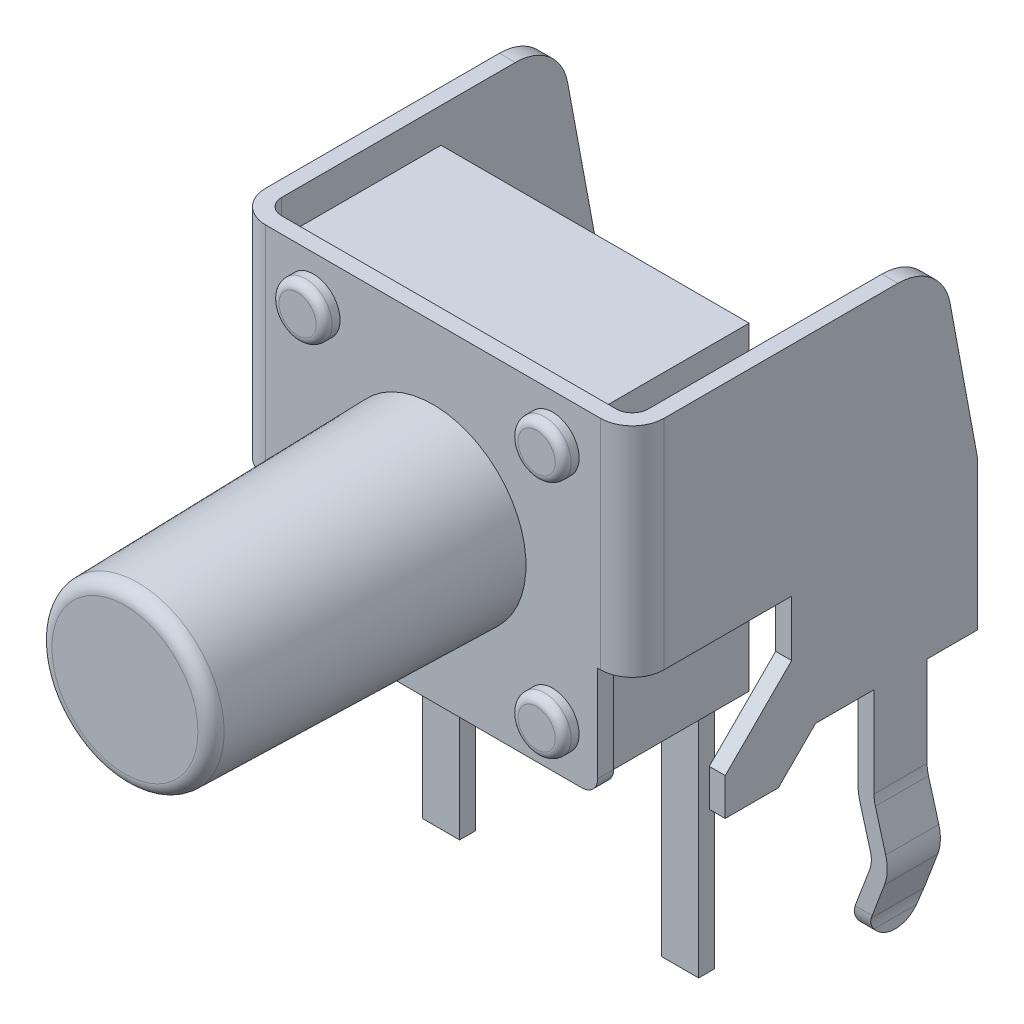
SolidWorks part; units mm, degrees
ref_plane "Front" through (0, 0, 0) normal (0, 0, 1) x (1, 0, 0)
ref_plane "Top" through (0, 0, 0) normal (0, 1, 0) x (1, 0, 0)
ref_plane "Right" through (0, 0, 0) normal (1, 0, 0) x (0, 0, -1)
sketch "Эскиз1" plane through (0, 0, 0) normal (0, 0, 1) x (1, 0, 0)
  line L0 (0, 0) -> (0, 7) construction
  line L1 (-2.9, 1) -> (2.9, 1)
  line L2 (-2.9, 1) -> (-2.9, 7)
  line L3 (-2.9, 7) -> (2.9, 7)
  line L4 (2.9, 1) -> (2.9, 7)
  dimension "D1" = 5.8
  dimension "D2" = 1
  dimension "D3" = 7
extrude "Вытянуть1" add sketch "Эскиз1" along normal blind 2.25 and the other way blind 0.5
sketch "Эскиз2" plane through (0, 0, 0) normal (0, 1, 0) x (1, 0, 0)
  line L0 (-3.15, -2.25) -> (3.15, -2.25)
  line L1 (2.9, -2.25) -> (-2.9, -2.25) construction
  line L2 (3.45, -1.95) -> (3.45, 3.95)
  line L3 (0, -2.25) -> (0, 0) construction
  line L4 (-3.15, -2.55) -> (3.15, -2.55)
  line L5 (3.75, -1.95) -> (3.75, 3.95)
  line L6 (3.45, 3.95) -> (3.75, 3.95)
  line L7 (-3.45, 3.95) -> (-3.75, 3.95)
  line L8 (-3.75, -1.95) -> (-3.75, 3.95)
  line L9 (-3.45, -1.95) -> (-3.45, 3.95)
  arc A0 (3.15, -2.25) -> (3.45, -1.95) centre (3.15, -1.95) ccw
  arc A1 (3.15, -2.55) -> (3.75, -1.95) centre (3.15, -1.95) ccw
  arc A2 (-3.15, -2.55) -> (-3.75, -1.95) centre (-3.15, -1.95) cw
  arc A3 (-3.15, -2.25) -> (-3.45, -1.95) centre (-3.15, -1.95) cw
  dimension "D1" = 0.3
  dimension "D3" = 7.5
  dimension "D4" = 6.5
  dimension "D2" = 0.3
extrude "Вытянуть2" add sketch "Эскиз2" along normal blind 7.1
sketch "Эскиз3" plane through (0, 0, 0) normal (0, 0, 1) x (1, 0, 0)
  line L0 (3.45, 0) -> (3.45, -1)
  line L1 (3.15, 0) -> (3.75, 0) construction
  line L2 (3.4869, -1.2692) -> (3.6815, -1.9654)
  line L3 (3.6677, -2.2768) -> (3.4146, -2.9464)
  line L4 (3.35, -3.3) -> (3.35, -3.5)
  line L5 (3.75, 0) -> (3.75, -1)
  line L6 (3.7758, -1.1885) -> (3.9705, -1.8846)
  line L7 (3.9483, -2.3829) -> (3.6952, -3.0525)
  line L8 (3.65, -3.3) -> (3.65, -3.5)
  line L9 (3.45, 0) -> (3.75, 0)
  line L10 (3.65, -3.5) -> (3.35, -3.5)
  line L11 (-3.5, -3.5) -> (-3.5, -3.6731) construction
  line L12 (3.5, -3.5) -> (3.5, -3.6731) construction
  line L13 (0, 0) -> (0, 2.0912) construction
  line L14 (-3.65, -3.5) -> (-3.35, -3.5)
  line L15 (-3.45, 0) -> (-3.75, 0)
  line L16 (-3.65, -3.3) -> (-3.65, -3.5)
  line L17 (-3.9483, -2.3829) -> (-3.6952, -3.0525)
  line L18 (-3.7758, -1.1885) -> (-3.9705, -1.8846)
  line L19 (-3.75, 0) -> (-3.75, -1)
  line L20 (-3.35, -3.3) -> (-3.35, -3.5)
  line L21 (-3.6677, -2.2768) -> (-3.4146, -2.9464)
  line L22 (-3.4869, -1.2692) -> (-3.6815, -1.9654)
  line L23 (-3.45, 0) -> (-3.45, -1)
  line L24 (-3.15, 0) -> (3.15, 0) construction
  arc A0 (3.6815, -1.9654) -> (3.6677, -2.2768) centre (3.2, -2.1) cw
  arc A1 (3.45, -1) -> (3.4869, -1.2692) centre (4.45, -1) ccw
  arc A2 (3.4146, -2.9464) -> (3.35, -3.3) centre (4.35, -3.3) ccw
  arc A3 (3.75, -1) -> (3.7758, -1.1885) centre (4.45, -1) ccw
  arc A4 (3.9705, -1.8846) -> (3.9483, -2.3829) centre (3.2, -2.1) cw
  arc A5 (3.6952, -3.0525) -> (3.65, -3.3) centre (4.35, -3.3) ccw
  arc A6 (-3.6952, -3.0525) -> (-3.65, -3.3) centre (-4.35, -3.3) cw
  arc A7 (-3.9705, -1.8846) -> (-3.9483, -2.3829) centre (-3.2, -2.1) ccw
  arc A8 (-3.75, -1) -> (-3.7758, -1.1885) centre (-4.45, -1) cw
  arc A9 (-3.4146, -2.9464) -> (-3.35, -3.3) centre (-4.35, -3.3) cw
  arc A10 (-3.45, -1) -> (-3.4869, -1.2692) centre (-4.45, -1) cw
  arc A11 (-3.6815, -1.9654) -> (-3.6677, -2.2768) centre (-3.2, -2.1) ccw
  dimension "D1" = 0.5
  dimension "D2" = 1
  dimension "D4" = 8
  dimension "D3" = 7
  dimension "D5" = 3.5
  dimension "D6" = 0.2
  dimension "D7" = 1.4
  dimension "D8" = 2.5
extrude "Вытянуть3" add sketch "Эскиз3" against normal up to surface (3.95 mm away)
sketch "Эскиз4" plane through (0, 0, 0) normal (1, 0, 0) x (0, 0, -1)
  line L0 (-2.55, 7.1) -> (-2.55, 0) construction
  line L2 (-2.55, -4.5) -> (-2.55, 3)
  line L3 (-2.55, 3) -> (0.45, 3)
  line L4 (0.45, 1.95) -> (-0.8, 0.7)
  line L5 (-0.8, 0.7) -> (-0.8, 0)
  line L6 (-1.95, 0) -> (0, 0) construction
  line L7 (-0.8, 0) -> (0.2, 0)
  line L8 (0.2, 0) -> (0.9, 0.7)
  line L9 (0.9, 0.7) -> (2, 0.7)
  line L10 (2, 0.7) -> (2, -3)
  line L11 (3, -3) -> (3, 0.7)
  line L12 (3, 0.7) -> (3.95, 0.7)
  line L13 (3.95, 7.1) -> (3.95, -1) construction
  line L14 (3.95, -3.5) -> (0, -3.5) construction
  line L15 (-2.55, -4.5) -> (3.95, -4.5)
  line L16 (3.95, -4.5) -> (3.95, 0.7)
  line L17 (0, -1) -> (0, 0) construction
  line L18 (0.45, 3) -> (0.45, 1.95)
  line L19 (3.95, 3.5) -> (3.4332, 6.2826)
  line L20 (-1.95, 7.1) -> (3.95, 7.1) construction
  line L21 (2.45, 7.1) -> (3.95, 7.1)
  line L22 (3.95, 7.1) -> (3.95, 3.5)
  arc A0 (2, -3) -> (3, -3) centre (2.5, -3) ccw
  arc A1 (3.4332, 6.2826) -> (2.45, 7.1) centre (2.45, 6.1) ccw
  dimension "D11" = 1
  dimension "D1" = 1
  dimension "D2" = 2.5
  dimension "D3" = 1
  dimension "D4" = 0.7
  dimension "D5" = 0.2
  dimension "D6" = 0.8
  dimension "D7" = 45
  dimension "D8" = 3
  dimension "D9" = 3
  dimension "D10" = 2.8
  dimension "D12" = 1.5
extrude "Вырез-Вытянуть1" cut sketch "Эскиз4" along normal through all from offset 3.2
mirror "Зеркальное отражение1" about plane through (0, 0, 0) normal (1, 0, 0) of "Вырез-Вытянуть1"
sketch "Эскиз5" plane through (0, 0, 2.55) normal (0, 0, 1) x (1, 0, 0)
  line L0 (0, 0) -> (0, 0.9) construction
  line L1 (-3.1, 3) -> (-3.2, 3)
  line L2 (-3.1, 3) -> (-3.1, 1.2)
  line L3 (-2.8, 0.9) -> (2.8, 0.9)
  line L4 (3.1, 3) -> (3.1, 1.2)
  line L6 (-3.2, 3) -> (-3.2, 0)
  line L7 (-3.2, 0) -> (3.2, 0)
  line L8 (3.2, 0) -> (3.2, 3)
  line L9 (3.2, 3) -> (3.2, 0) construction
  line L10 (3.2, 3) -> (3.1, 3)
  line L11 (-3.15, 7.1) -> (3.15, 7.1) construction
  line L12 (-3.75, 3) -> (-3.2, 3) construction
  arc A0 (-3.1, 1.2) -> (-2.8, 0.9) centre (-2.8, 1.2) ccw
  arc A1 (2.8, 0.9) -> (3.1, 1.2) centre (2.8, 1.2) ccw
  dimension "D1" = 0.3
  dimension "D2" = 6.2
  dimension "D3" = 6.2
extrude "Вырез-Вытянуть2" cut sketch "Эскиз5" against normal up to next
sketch "Эскиз6" plane through (0, 0, 0) normal (0, 1, 0) x (1, 0, 0)
  line L0 (0, 0) -> (0, 1.2061) construction
  line L1 (-2.6, -0.15) -> (-1.9, -0.15)
  line L2 (-2.6, -0.15) -> (-2.6, 0.15)
  line L3 (-2.6, 0.15) -> (-1.9, 0.15)
  line L4 (-1.9, -0.15) -> (-1.9, 0.15)
  line L5 (1.9, -0.15) -> (1.9, 0.15)
  line L6 (2.6, 0.15) -> (1.9, 0.15)
  line L7 (2.6, -0.15) -> (2.6, 0.15)
  line L8 (2.6, -0.15) -> (1.9, -0.15)
  line L9 (-2.25, -0.15) -> (-2.25, 0.15) construction
  line L10 (2.25, -0.15) -> (2.25, 0.15) construction
  line L11 (-2.25, 0) -> (0, 0) construction
  dimension "D1" = 0.3
  dimension "D2" = 0.7
  dimension "D3" = 4.5
extrude "Вытянуть4" add sketch "Эскиз6" along normal blind 1 and the other way blind 3.5
sketch "Эскиз7" plane through (0, 0, 2.55) normal (0, 0, 1) x (1, 0, 0)
  circle A0 centre (0, 4) radius 1.75
  dimension "D2" = 3.5
  dimension "D1" = 4
extrude "Вытянуть5" add sketch "Эскиз7" along normal offset from surface 8.35 draft 1.3
sketch "Эскиз8" plane through (0, 0, 2.55) normal (0, 0, 1) x (1, 0, 0)
  line L0 (0, 4) -> (-2.9661, 4) construction
  line L1 (0, 4) -> (0, 6.7338) construction
  circle A0 centre (-2.25, 6.25) radius 0.5
  circle A1 centre (2.25, 6.25) radius 0.5
  circle A2 centre (-2.25, 1.75) radius 0.5
  circle A3 centre (2.25, 1.75) radius 0.5
  dimension "D1" = 4.5
  dimension "D2" = 4.5
  dimension "D3" = 1
extrude "Вытянуть6" add sketch "Эскиз8" along normal blind 0.3
fillet "Скругление1" radius 0.15 4 edges at (-2.75, 1.75, 2.85) (2.75, 1.75, 2.85) (1.75, 6.25, 2.85) (-1.75, 6.25, 2.85)
fillet "Скругление2" radius 0.25 1 edges at (1.6184, 4, 8.35)
